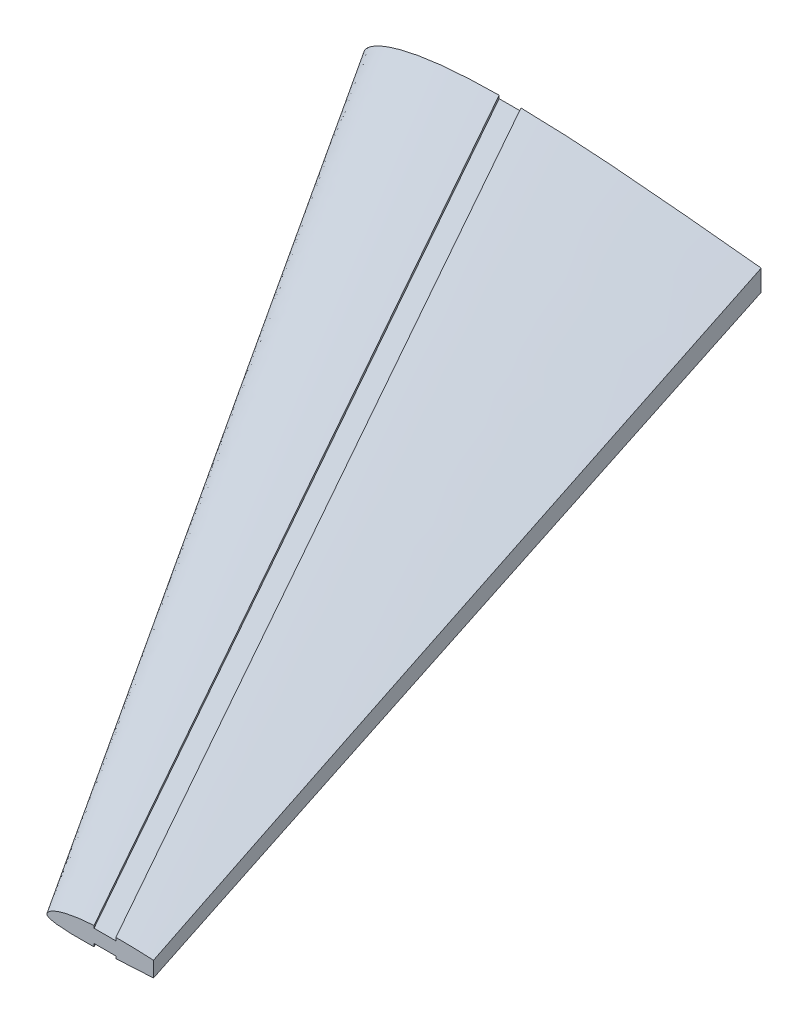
SolidWorks part; units mm, degrees
ref_plane "Front Plane" through (0, 0, 0) normal (0, 0, 1) x (1, 0, 0)
ref_plane "Top Plane" through (0, 0, 0) normal (0, 1, 0) x (1, 0, 0)
ref_plane "Right Plane" through (0, 0, 0) normal (1, 0, 0) x (0, 0, -1)
curve "Curve1"
sketch "Sketch1" plane through (0, 0, 0) normal (0, 0, 1) x (1, 0, 0)
  line L0 (350, 0.1645) -> (350, 0)
  spline S0 degree 3 number of poles 234 (350, 0.1645) -> (350, 0) construction
  spline S1 degree 3 number of poles 234 (350, 0.1645) -> (350, 0)
curve "Curve2"
ref_plane "Plane1" through (0, 0, 601) normal (0, 0, 1) x (1, 0, 0)
sketch "Sketch2" plane through (0, 0, 601) normal (0, 0, 1) x (1, 0, 0)
  line L0 (525.9333, 3.8863) -> (525.9355, 3.8224)
  spline S1 degree 3 number of poles 234 (525.9333, 3.8863) -> (525.9355, 3.8224)
loft "Loft1" add profiles "Sketch1", "Sketch2"
sketch "Sketch3" plane through (0, 0, 0) normal (0, 1, 0) x (1, 0, 0)
  line L0 (342, 25.8692) -> (342, 0)
  line L1 (350.0069, 0) -> (-0.0021, 0) construction
  line L2 (517.9394, -601) -> (517.9394, -608.0397)
  line L3 (-6.6694, -601) -> (6.6694, -601) construction
  line L5 (390.0156, -601) -> (525.9394, -601) construction
  line L6 (390.0156, -601) -> (525.9394, -601)
  line L7 (342, 0) -> (517.9394, -601)
  line L8 (517.9394, -608.0397) -> (557.5572, -596.1903)
  line L9 (557.5572, -596.1903) -> (340.8273, 128.4324)
  line L10 (340.8273, 128.4324) -> (342, 25.8692)
  dimension "D1" = 8
  dimension "D2" = 8
extrude "Cut-Extrude1" cut sketch "Sketch3" against normal through all both and the other way through all
sketch "Sketch4" plane through (0, 0, 0) normal (0, 0, -1) x (-1, 0, 0)
  line L0 (0, 0) -> (-96.25, 0)
  line L1 (-103.405, -8.5887) -> (-89.095, -8.5887)
  line L3 (-103.405, 20.5658) -> (-103.405, 18.5658)
  line L4 (-103.405, 18.5658) -> (-89.095, 18.5658)
  line L5 (-89.095, 20.5658) -> (-89.095, 18.5658)
  line L6 (-103.405, -8.5887) -> (-103.405, -10.5887)
  line L8 (-89.095, -8.5887) -> (-89.095, -10.5887)
  line L10 (-342, 0.5301) -> (-342, -0.6627)
  line L11 (-342, 0.5301) -> (-342, -0.6627)
  line L15 (-103.405, -10.5887) -> (-103.405, -29.2404)
  line L16 (-103.405, -29.2404) -> (-89.095, -29.2404)
  line L17 (-89.095, -29.2404) -> (-89.095, -10.5887)
  line L18 (-103.405, 20.5658) -> (-103.405, 33.9496)
  line L19 (-103.405, 33.9496) -> (-89.095, 33.9496)
  line L20 (-89.095, 33.9496) -> (-89.095, 20.5658)
  spline S3 degree 3 number of poles 213 (-342, -0.6627) -> (-342, 0.5301)
  spline S4 degree 3 number of poles 213 (-342, -0.6627) -> (-342, 0.5301)
  dimension "D1" = 96.25
  dimension "D2" = 14.31
  dimension "D3" = 2
  dimension "D4" = 7.155
  dimension "D5" = 7.155
  dimension "D7" = 14.31
  dimension "D6" = 0
sketch "Sketch5" plane through (0, 0, 601) normal (0, 0, 1) x (1, 0, 0)
  line L0 (420.4388, -1.9505) -> (434.7488, -1.9505)
  line L1 (389.9417, -0.9345) -> (427.5938, 0.3803)
  line L3 (420.4388, 8.4784) -> (420.4388, 6.4784)
  line L4 (420.4388, 6.4784) -> (434.7488, 6.4784)
  line L5 (434.7488, 8.4784) -> (434.7488, 6.4784)
  line L6 (420.4388, -1.9505) -> (420.4388, -3.9505)
  line L8 (434.7488, -1.9505) -> (434.7488, -3.9505)
  line L9 (420.4388, 8.4784) -> (420.4388, 14.3324)
  line L10 (517.9394, 2.9661) -> (517.9394, 4.1187)
  line L11 (517.9394, 2.9661) -> (517.9394, 4.1187)
  line L12 (420.4388, 14.3324) -> (434.7488, 14.3324)
  line L13 (434.7488, 14.3324) -> (434.7488, 8.4784)
  line L14 (420.4388, -3.9505) -> (420.4388, -10.3696)
  line L15 (420.4388, -10.3696) -> (434.7488, -10.3696)
  line L16 (434.7488, -10.3696) -> (434.7488, -3.9505)
  spline S1 degree 3 number of poles 199 (517.9394, 2.9661) -> (517.9394, 4.1187) construction
  spline S2 degree 3 number of poles 199 (517.9394, 4.1187) -> (517.9394, 2.9661)
  spline S3 degree 3 number of poles 199 (517.9394, 4.1187) -> (517.9394, 2.9661)
  dimension "D1" = 14.31
  dimension "D2" = 37.675
  dimension "D3" = 2
  dimension "D4" = 7.155
  dimension "D5" = 14.31
  dimension "D6" = 2
  dimension "D7" = 7.155
  dimension "D8" = 0
loft "Cut-Loft1" cut
sketch "Sketch6" plane through (0, 0, 601) normal (0, 0, 1) x (1, 0, 0)
  line L0 (389.9417, -0.9345) -> (427.5938, 0.3803) construction
  line L1 (517.9394, 2.9661) -> (517.9394, 4.1187)
  line L2 (517.9394, 2.9661) -> (517.9394, 4.1187)
  line L3 (389.9417, -0.9345) -> (427.5938, 0.3803)
  line L8 (420.4388, -10.3696) -> (434.7488, -10.3696)
  line L9 (434.7488, -10.3696) -> (434.7488, -3.9505)
  line L10 (434.7488, -3.9505) -> (434.7488, -1.9505)
  line L11 (434.7488, -1.9505) -> (420.4388, -1.9505)
  line L12 (420.4388, -1.9505) -> (420.4388, -3.9505)
  line L13 (420.4388, -3.9505) -> (420.4388, -10.3696)
  line L14 (420.4388, -10.3696) -> (434.7488, -10.3696)
  line L15 (434.7488, -10.3696) -> (434.7488, -3.9505)
  line L16 (434.7488, -3.9505) -> (434.7488, -1.9505)
  line L17 (434.7488, -1.9505) -> (420.4388, -1.9505)
  line L18 (420.4388, -1.9505) -> (420.4388, -3.9505)
  line L19 (420.4388, -3.9505) -> (420.4388, -10.3696)
  line L20 (434.7488, 14.3324) -> (420.4388, 14.3324)
  line L21 (434.7488, 8.4784) -> (434.7488, 14.3324)
  line L22 (434.7488, 6.4784) -> (434.7488, 8.4784)
  line L23 (420.4388, 6.4784) -> (434.7488, 6.4784)
  line L24 (420.4388, 8.4784) -> (420.4388, 6.4784)
  line L25 (420.4388, 14.3324) -> (420.4388, 8.4784)
  line L26 (434.7488, 14.3324) -> (420.4388, 14.3324)
  line L27 (434.7488, 8.4784) -> (434.7488, 14.3324)
  line L28 (434.7488, 6.4784) -> (434.7488, 8.4784)
  line L29 (420.4388, 6.4784) -> (434.7488, 6.4784)
  line L30 (420.4388, 8.4784) -> (420.4388, 6.4784)
  line L31 (420.4388, 14.3324) -> (420.4388, 8.4784)
  spline S1 degree 3 number of poles 199 (517.9394, 4.1187) -> (517.9394, 2.9661)
  spline S2 degree 3 number of poles 199 (517.9394, 4.1187) -> (517.9394, 2.9661)
  dimension "D1" = 0
  dimension "D2" = 0
  dimension "D3" = 0
sketch "Sketch7" plane through (0, 0, 0) normal (0, 0, -1) x (-1, 0, 0)
  line L0 (0, 0) -> (-96.25, 0) construction
  line L1 (-342, 0.5301) -> (-342, -0.6627)
  line L2 (-342, 0.5301) -> (-342, -0.6627)
  line L3 (0, 0) -> (-96.25, 0)
  line L8 (-89.095, -8.5887) -> (-103.405, -8.5887)
  line L9 (-89.095, -10.5887) -> (-89.095, -8.5887)
  line L10 (-89.095, -29.2404) -> (-89.095, -10.5887)
  line L11 (-103.405, -29.2404) -> (-89.095, -29.2404)
  line L12 (-103.405, -10.5887) -> (-103.405, -29.2404)
  line L13 (-103.405, -8.5887) -> (-103.405, -10.5887)
  line L14 (-89.095, -8.5887) -> (-103.405, -8.5887)
  line L15 (-89.095, -10.5887) -> (-89.095, -8.5887)
  line L16 (-89.095, -29.2404) -> (-89.095, -10.5887)
  line L17 (-103.405, -29.2404) -> (-89.095, -29.2404)
  line L18 (-103.405, -10.5887) -> (-103.405, -29.2404)
  line L19 (-103.405, -8.5887) -> (-103.405, -10.5887)
  line L20 (-89.095, 33.9496) -> (-103.405, 33.9496)
  line L21 (-89.095, 20.5658) -> (-89.095, 33.9496)
  line L22 (-89.095, 18.5658) -> (-89.095, 20.5658)
  line L23 (-103.405, 18.5658) -> (-89.095, 18.5658)
  line L24 (-103.405, 20.5658) -> (-103.405, 18.5658)
  line L25 (-103.405, 33.9496) -> (-103.405, 20.5658)
  line L26 (-89.095, 33.9496) -> (-103.405, 33.9496)
  line L27 (-89.095, 20.5658) -> (-89.095, 33.9496)
  line L28 (-89.095, 18.5658) -> (-89.095, 20.5658)
  line L29 (-103.405, 18.5658) -> (-89.095, 18.5658)
  line L30 (-103.405, 20.5658) -> (-103.405, 18.5658)
  line L31 (-103.405, 33.9496) -> (-103.405, 20.5658)
  spline S1 degree 3 number of poles 213 (-342, -0.6627) -> (-342, 0.5301)
  spline S2 degree 3 number of poles 213 (-342, -0.6627) -> (-342, 0.5301)
  dimension "D1" = 0
  dimension "D2" = 0
  dimension "D3" = 0
loft "Cut-Loft2" cut
sketch "Sketch8" plane through (0, 0, 0) normal (0, 1, 0) x (1, 0, 0)
  line L0 (-55.6253, -5) -> (438.4371, -5)
  line L1 (438.4371, -5) -> (438.4371, 103.5577)
  line L2 (438.4371, 103.5577) -> (-55.6253, 103.5577)
  line L3 (-55.6253, 103.5577) -> (-55.6253, -5)
  line L4 (89.095, 0) -> (-0.0021, 0) construction
  line L5 (312.2544, -596) -> (652.6912, -596)
  line L6 (652.6912, -596) -> (652.6912, -634.6226)
  line L7 (652.6912, -634.6226) -> (312.2544, -634.6226)
  line L8 (312.2544, -634.6226) -> (312.2544, -596)
  line L9 (-6.6694, -601) -> (6.6694, -601) construction
  dimension "D1" = 5
  dimension "D2" = 5
extrude "Cut-Extrude3" cut sketch "Sketch8" against normal through all both and the other way through all
sketch "Sketch9" plane through (0, 0, 0) normal (0, 1, 0) x (1, 0, 0)
  line L2 (29.1135, -197.1777) -> (824.0019, 62.6941) construction
  line L3 (232.9034, 88.3078) -> (474.7031, -651.3021)
  line L5 (232.9034, 88.3078) -> (544.2441, 79.2226)
  line L6 (544.2441, 79.2226) -> (620.4801, -657.5832)
  line L7 (620.4801, -657.5832) -> (474.7031, -651.3021)
extrude "Cut-Extrude5" cut sketch "Sketch9" against normal through all both and the other way through all
